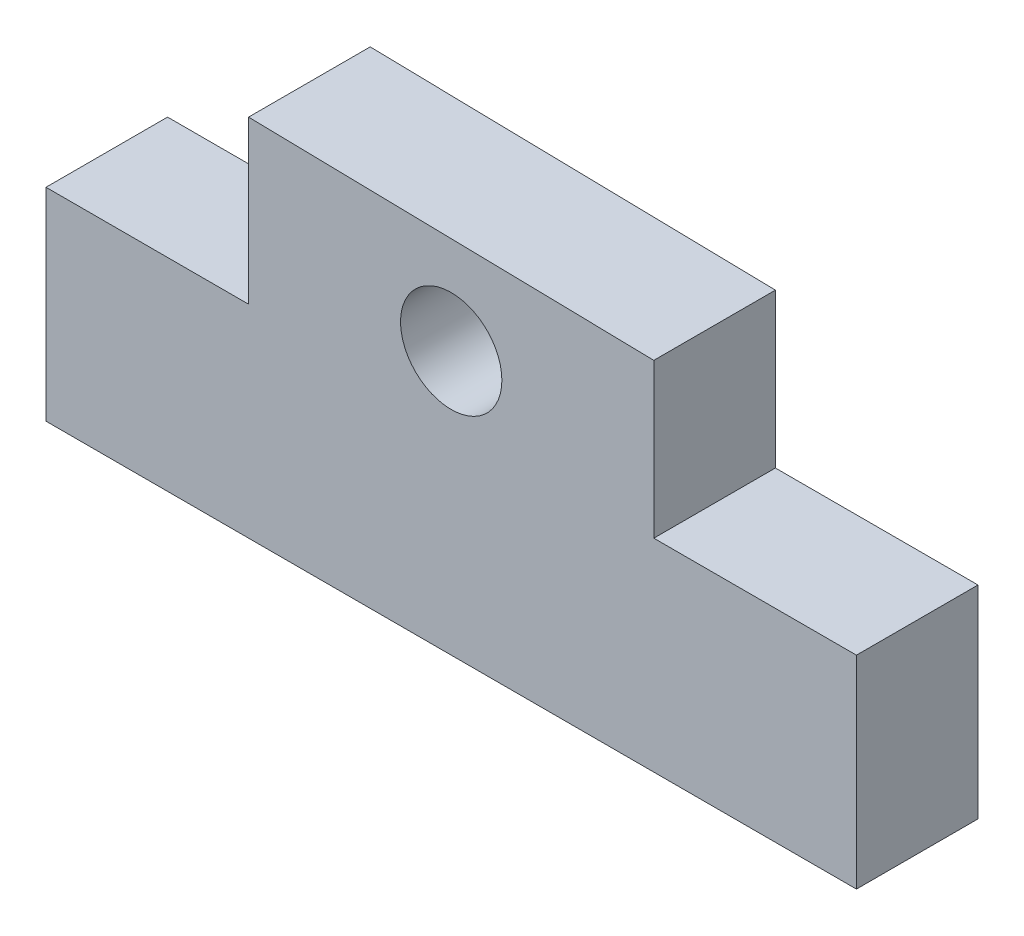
SolidWorks part; units mm, degrees
ref_plane "Front Plane" through (0, 0, 0) normal (0, 0, 1) x (1, 0, 0)
ref_plane "Top Plane" through (0, 0, 0) normal (0, 1, 0) x (1, 0, 0)
ref_plane "Right Plane" through (0, 0, 0) normal (1, 0, 0) x (0, 0, -1)
sketch "Sketch1" plane through (0, 0, 0) normal (0, 0, 1) x (1, 0, 0)
  line L195 (50.3873, 261.7073) -> (60.3873, 261.5088)
  line L198 (65.3873, 252.7073) -> (65.3873, 257.7073)
  line L205 (50.3873, 257.7073) -> (50.3873, 261.7073)
  line L206 (45.3873, 252.7073) -> (45.3873, 257.7073)
  line L207 (60.3873, 261.5088) -> (60.3873, 257.7073)
  line L208 (65.3873, 257.7073) -> (65.3873, 252.7073)
  line L209 (65.3873, 252.7073) -> (45.3873, 252.7073)
  line L210 (45.3873, 257.7073) -> (50.3873, 257.7073)
  line L211 (60.3873, 257.7073) -> (65.3873, 257.7073)
  circle A52 centre (55.3873, 259.2073) radius 1.25
extrude "Boss-Extrude1" add sketch "Sketch1" along normal blind 3 contours L211 L207 L195 L205 L210 L206 L209 L198 A52
